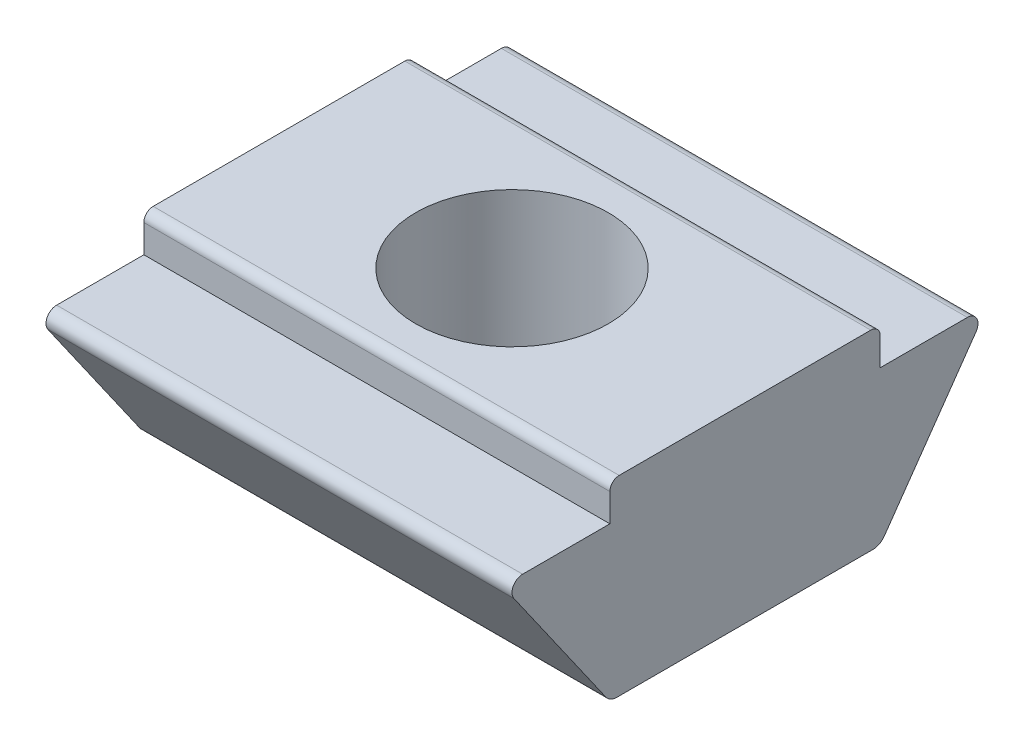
SolidWorks part; units mm, degrees
ref_plane "Front Plane" through (0, 0, 0) normal (0, 0, 1) x (1, 0, 0)
ref_plane "Top Plane" through (0, 0, 0) normal (0, 1, 0) x (1, 0, 0)
ref_plane "Right Plane" through (0, 0, 0) normal (1, 0, 0) x (0, 0, -1)
sketch "Sketch1" plane through (0, 0, 0) normal (1, 0, 0) x (0, 0, -1)
  line L0 (2.9, -3.3) -> (-2.9, -3.3)
  line L1 (-2.9, -3.3) -> (-4.9588, -0.3587)
  line L2 (-4.772, 0) -> (-2.9, 0)
  line L3 (-2.9, 0) -> (-2.9, 0.8)
  line L4 (-2.9, 0.8) -> (2.9, 0.8)
  line L5 (2.9, 0.8) -> (2.9, 0)
  line L6 (2.9, 0) -> (4.772, 0)
  line L7 (4.9588, -0.3587) -> (2.9, -3.3)
  line L8 (0, 0.8) -> (0, -3.3) construction
  line L9 (5, -0.228) -> (5, 0) construction
  line L10 (-5, 0) -> (-5, -0.228) construction
  line L11 (-4.772, 0) -> (-5, 0) construction
  line L12 (4.772, 0) -> (5, 0) construction
  arc A0 (-4.9588, -0.3587) -> (-4.772, 0) centre (-4.772, -0.228) cw
  arc A1 (4.772, 0) -> (4.9588, -0.3587) centre (4.772, -0.228) cw
  point P13 (-5.2099, 0)
  point P16 (5.2099, 0)
  dimension "FIX_4" = 0.228
  dimension "FIX_6" = 4.1
  dimension "FIX_5" = 5.8
  dimension "FIX_2" = 3.3
  dimension "FIX_1" = 10
  dimension "FIX_3" = 5.8
extrude "Boss-Extrude1" add sketch "Sketch1" along normal mid plane 10
fillet "Fillet1" radius 0.2 2 edges at (0, 0.8, -2.9) (0, 0.8, 2.9)
fillet "Fillet2" radius 0.3 2 edges at (0, -3.3, -2.9) (0, -3.3, 2.9)
hole_wizard "Tap1" positions "Sketch3" profile "Sketch2" hole size "M5x0.8" standard "JIS"
sketch "Sketch3" plane through (0, 0.8, 0) normal (0, 1, 0) x (1, 0, 0)
  point P0 (0, 0)
sketch "Sketch2" plane through (0, 0.8, 0) normal (1, 0, 0) x (0, 0, 1)
  line L0 (0, 0) -> (0, 4.1)
  line L1 (0, 4.1) -> (2.067, 4.1)
  line L2 (2.067, 4.1) -> (2.067, 0)
  line L5 (2.067, 0) -> (0, 0)
  line L11 (0, 0) -> (0, 4.1) construction
  dimension "Thru Hole Dia." = 4.134
  dimension "Thru Hole Depth" = 4.1
sketch "Sketch4" [suppressed] plane through (0, 0, 0) normal (1, 0, 0) x (0, 0, -1)
  line L0 (5, -5.5) -> (-5, -5.5)
  line L1 (-7.5, 0) -> (-7.5, -3.5)
  line L2 (-7.5, 0) -> (-3.9, 0)
  line L3 (-3.9, 0) -> (-3.9, 0.8)
  line L4 (-3.9, 0.8) -> (3.9, 0.8)
  line L5 (3.9, 0.8) -> (3.9, 0)
  line L6 (3.9, 0) -> (7.5, 0)
  line L7 (7.5, 0) -> (7.5, -3.5)
  line L8 (7.5, -3.5) -> (5, -5.5)
  line L9 (0, 0.8) -> (0, -5.5) construction
  line L10 (-7.5, -3.5) -> (-5, -5.5)
  point P15 (-7.5, 0)
  point P18 (-7.5, -3.5)
  point P21 (-5, -5.5)
  point P24 (5, -5.5)
  point P27 (7.5, -3.5)
  point P30 (7.5, 0)
  dimension "FIX_10" = 7.8
  dimension "FIX_11" = 6.3
  dimension "FIX_12" = 15
  dimension "FIX_13" = 5.5
  dimension "FIX_14" = 10
  dimension "FIX_15" = 2
extrude "Boss-Extrude2" [suppressed] add sketch "Sketch4" along normal mid plane 14 separate body
fillet "Fillet3" [suppressed] radius 1
fillet "Fillet4" [suppressed] radius 1
hole_wizard "Tap2" positions "Sketch6" profile "Sketch5" hole size "M6x1.0" standard "JIS"
sketch "Sketch6" [suppressed] plane through (0, 0.8, 0) normal (0, 1, 0) x (1, 0, 0)
  point P0 (0, 0)
sketch "Sketch5" [suppressed] plane through (0, 0.8, 0) normal (1, 0, 0) x (0, 0, 1)
  line L0 (0, 0) -> (0, 6.3)
  line L1 (0, 6.3) -> (2.4585, 6.3)
  line L2 (2.4585, 6.3) -> (2.4585, 0)
  line L5 (2.4585, 0) -> (0, 0)
  line L11 (0, 0) -> (0, 6.3) construction
  dimension "Thru Hole Dia." = 4.917
  dimension "Thru Hole Depth" = 6.3
sketch "Sketch7" [suppressed] plane through (0, 0, 0) normal (1, 0, 0) x (0, 0, -1)
  line L0 (5, -6) -> (-5, -6)
  line L1 (-8.5, 0) -> (-8.5, -2.5)
  line L2 (-8.5, 0) -> (-4.9, 0)
  line L3 (-4.9, 0) -> (-4.9, 3)
  line L4 (-4.9, 3) -> (4.9, 3)
  line L5 (4.9, 3) -> (4.9, 0)
  line L6 (4.9, 0) -> (8.5, 0)
  line L7 (8.5, 0) -> (8.5, -2.5)
  line L8 (8.5, -2.5) -> (5, -6)
  line L9 (0, 3) -> (0, -6) construction
  line L10 (-8.5, -2.5) -> (-5, -6)
  point P15 (-8.5, 0)
  point P18 (-8.5, -2.5)
  point P21 (-5, -6)
  point P24 (5, -6)
  point P27 (8.5, -2.5)
  point P30 (8.5, 0)
  dimension "FIX_19" = 9.8
  dimension "FIX_20" = 9
  dimension "FIX_21" = 17
  dimension "FIX_22" = 6
  dimension "FIX_23" = 10
  dimension "FIX_24" = 3.5
extrude "Boss-Extrude3" [suppressed] add sketch "Sketch7" along normal mid plane 17 separate body
fillet "Fillet5" [suppressed] radius 1
hole_wizard "Tap3" positions "Sketch9" profile "Sketch8" hole size "M8x1.25" standard "JIS"
sketch "Sketch9" [suppressed] plane through (0, 3, 0) normal (0, 1, 0) x (1, 0, 0)
  point P0 (0, 0)
sketch "Sketch8" [suppressed] plane through (0, 3, 0) normal (1, 0, 0) x (0, 0, 1)
  line L0 (0, 0) -> (0, 9)
  line L1 (0, 9) -> (3.3235, 9)
  line L2 (3.3235, 9) -> (3.3235, 0)
  line L5 (3.3235, 0) -> (0, 0)
  line L11 (0, 0) -> (0, 9) construction
  dimension "Thru Hole Dia." = 6.647
  dimension "Thru Hole Depth" = 9
